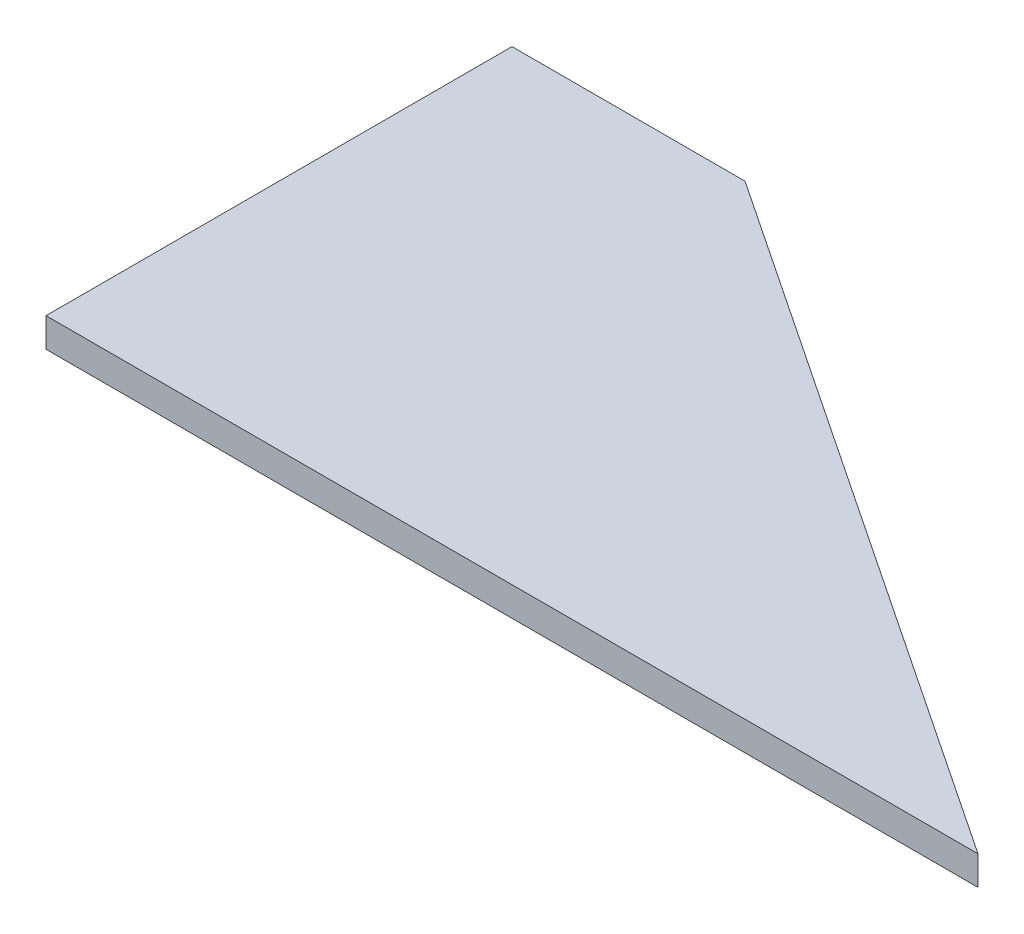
SolidWorks part; units mm, degrees
ref_plane "FRONT" through (0, 0, 0) normal (0, 0, 1) x (1, 0, 0)
ref_plane "TOP" through (0, 0, 0) normal (0, 1, 0) x (1, 0, 0)
ref_plane "RIGHT" through (0, 0, 0) normal (1, 0, 0) x (0, 0, -1)
sketch "Sketch1" plane through (0, 0, 0) normal (0, 1, 0) x (1, 0, 0)
  line L0 (0, 0) -> (0, 152.4)
  line L1 (0, 0) -> (304.8, 0)
  line L2 (304.8, 0) -> (76.2, 152.4)
  line L4 (76.2, 152.4) -> (0, 152.4)
  dimension "D1" = 76.2
  dimension "D2" = 152.4
  dimension "D3" = 304.8
extrude "Boss-Extrude1" add sketch "Sketch1" along normal blind 9.525
